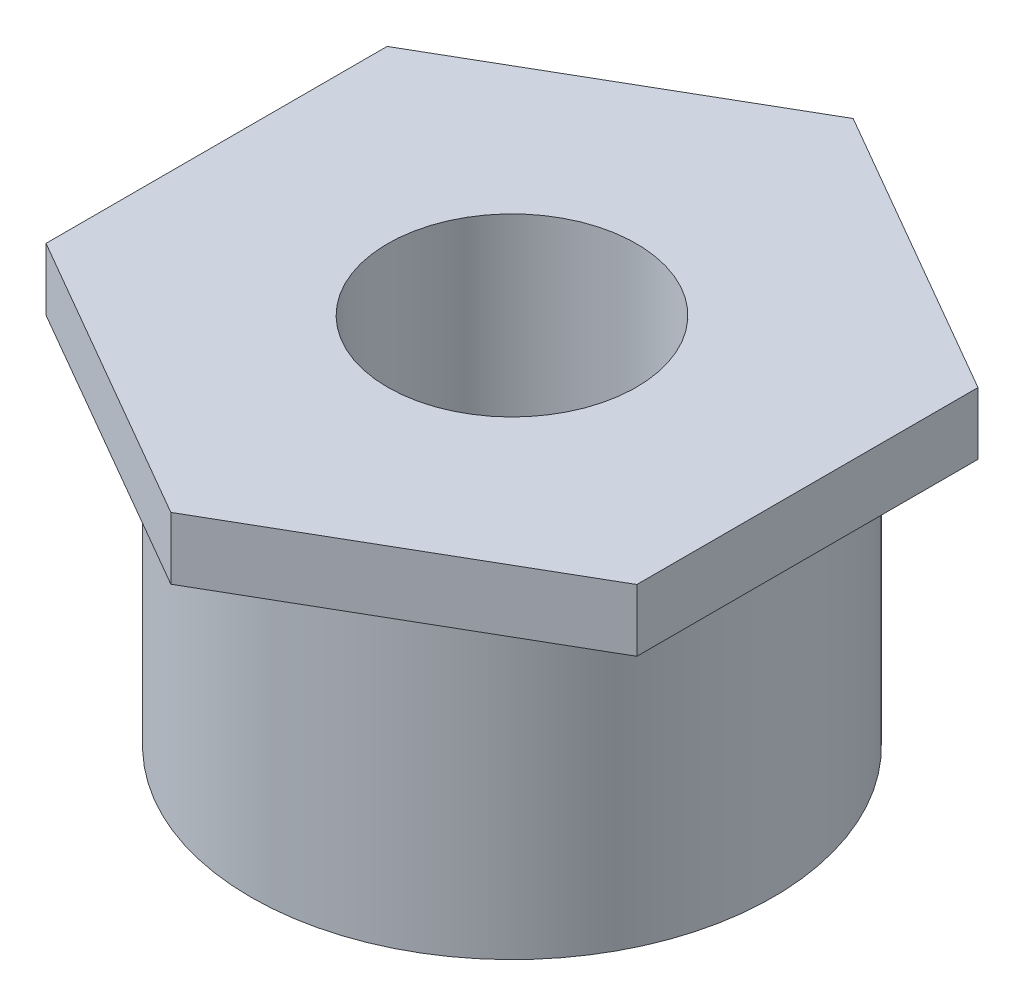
SolidWorks part; units mm, degrees
ref_plane "前视基准面" through (0, 0, 0) normal (0, 0, 1) x (1, 0, 0)
ref_plane "上视基准面" through (0, 0, 0) normal (0, 1, 0) x (1, 0, 0)
ref_plane "右视基准面" through (0, 0, 0) normal (1, 0, 0) x (0, 0, -1)
other "Configuration Table"
sketch "草图1" plane through (0, 0, 0) normal (0, 1, 0) x (1, 0, 0)
  circle A2 centre (0, 0) radius 2.1
  circle A3 centre (0, 0) radius 1
  dimension "D1" = 4.2
  dimension "D2" = 2
extrude "凸台-拉伸1" add sketch "草图1" against normal blind 3 contours A2 A3
sketch "草图2" plane through (0, 0, 0) normal (0, 1, 0) x (1, 0, 0)
  line L1 (0, 2.7424) -> (-2.375, 1.3712)
  line L2 (-2.375, 1.3712) -> (-2.375, -1.3712)
  line L3 (-2.375, -1.3712) -> (0, -2.7424)
  line L4 (0, -2.7424) -> (2.375, -1.3712)
  line L5 (2.375, -1.3712) -> (2.375, 1.3712)
  line L6 (2.375, 1.3712) -> (0, 2.7424)
  circle A0 centre (0, 0) radius 1 construction
  circle A1 centre (0, 0) radius 2.1
  circle A2 centre (0, 0) radius 2.1
  circle A3 centre (0, 0) radius 1
  circle A4 centre (0, 0) radius 2.375 construction
  dimension "D2" = 4.75
  dimension "D1" = 0
extrude "凸台-拉伸2" add sketch "草图2" against normal blind 0.5 contours L5 L6 L1 L2 L3 L4 M10
